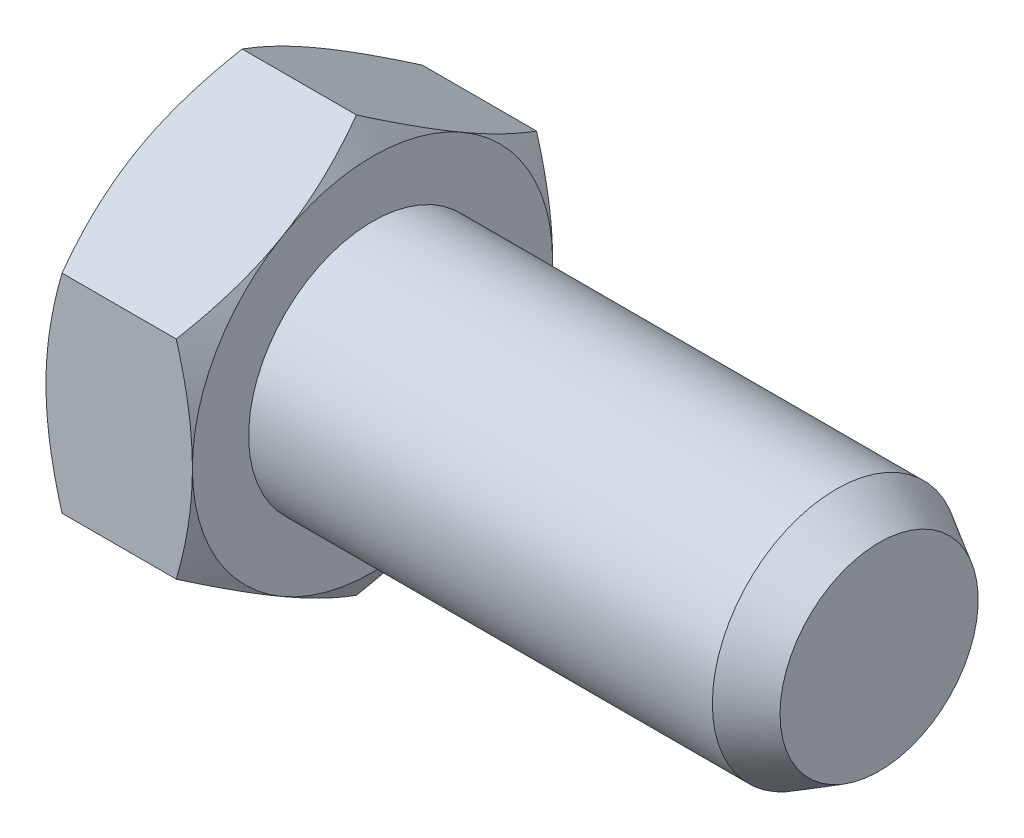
SolidWorks part; units mm, degrees
ref_plane "Front" through (0, 0, 0) normal (0, 0, 1) x (1, 0, 0)
ref_plane "Top" through (0, 0, 0) normal (0, 1, 0) x (1, 0, 0)
ref_plane "Right" through (0, 0, 0) normal (1, 0, 0) x (0, 0, -1)
sketch "Sketch1" plane through (0, 0, 0) normal (0, 0, 1) x (1, 0, 0)
  line L0 (0, 0) -> (0, 1.4)
  line L1 (0, 1.4) -> (1.3, 1.4)
  line L2 (1.3, 1.4) -> (1.3, 1.1)
  line L4 (1.3, 1.1) -> (5.8, 1.1)
  line L5 (5.8, 1.1) -> (5.8, 0)
  line L6 (5.8, 0) -> (0, 0)
  line L7 (13.1079, 0) -> (-2.2203, 0) construction
  dimension "da" = 2.8
  dimension "d" = 2.2
  dimension "k" = 1.3
  dimension "l" = 4.5
revolve "Revolve1" add sketch "Sketch1" angle 360 about L7
sketch "Sketch2" plane through (0, 0, 0) normal (-1, 0, 0) x (0, 0, 1)
  line L1 (1.6, -0.9238) -> (1.6, 0.9238)
  line L2 (1.6, 0.9238) -> (0, 1.8475)
  line L3 (0, 1.8475) -> (-1.6, 0.9238)
  line L4 (-1.6, 0.9238) -> (-1.6, -0.9238)
  line L5 (-1.6, -0.9238) -> (0, -1.8475)
  line L6 (0, -1.8475) -> (1.6, -0.9238)
  circle A0 centre (0, 0) radius 1.6 construction
  dimension "s" = 3.2
extrude "Extrude1" add sketch "Sketch2" against normal blind 1.3
sketch "Sketch3" plane through (0, 0, 0) normal (0, 1, 0) x (1, 0, 0)
  line L0 (-0.9238, 0) -> (0.65, 2.7258)
  line L1 (0.65, 2.7258) -> (1.3, 1.6)
  line L2 (0, 0) -> (-2.2444, 0) construction
  line L4 (1.3, 1.6) -> (1.3, 3.2258)
  line L5 (1.3, 3.2258) -> (-1.0238, 3.2258)
  line L6 (-0.9238, 0) -> (-1.0238, 0)
  line L7 (-1.0238, 0) -> (-1.0238, 3.2258)
  dimension "D1" = 60
  dimension "D2" = 0.5
  dimension "D3" = 0.1
  dimension "D4" = 60
revolve "Cut-Revolve2" cut sketch "Sketch3" angle 360 about L2
sketch "Sketch4" plane through (0, 0, 0) normal (0, 0, 1) x (1, 0, 0)
  line L0 (0, 0) -> (1.9538, 0) construction
  line L1 (-0.2, 0) -> (-0.2, 1.28)
  line L2 (-0.2, 1.28) -> (0.4, 1.28)
  line L3 (0.4, 1.28) -> (0.4, 0)
  line L4 (1.3, 1.4) -> (1.3, 1.1) construction
  line L5 (1.3, 1.4) -> (1.3, 1.8049) construction
  line L6 (0.4, 0) -> (-0.2, 0)
  dimension "D1" = 0.2
  dimension "D2" = 2.56
  dimension "k'" = 0.9
revolve "Cut-Revolve3" cut sketch "Sketch4" angle 360 about L0
chamfer "Chamfer1" distance 0.22 angle 60 1 edges at (5.8, 0, -1.1)
sketch "Sketch6" plane through (0, 0, 0) normal (0, 0, 1) x (1, 0, 0)
  line L0 (1.627, 0.75) -> (1.5502, 0.75)
  line L1 (1.5502, 0.75) -> (1.3481, 1.1)
  line L2 (1.627, 0.75) -> (1.829, 1.1)
  line L3 (1.3481, 1.1) -> (1.3481, 1.35)
  line L4 (1.829, 1.1) -> (1.829, 1.35)
  line L5 (1.3481, 1.35) -> (1.829, 1.35)
  line L6 (1.5886, 0.75) -> (1.5886, 0) construction
  line L7 (0, 0) -> (7.3035, 0) construction
  dimension "D1" = 2.2
  dimension "D2" = 60
  dimension "D3" = 0.25
  dimension "threadstart" = 1.5886
  dimension "minordia" = 1.5
  dimension "advance" = 0.4809
revolve "ThreadSchematic" [suppressed] cut sketch "Sketch6" angle 360 about L7
pattern_linear "ThdSchPat" [suppressed] count 10 spacing 0.4809 along (-1, 0, 0)
sketch "Sketch5" plane through (0, 0, 0) normal (0, 0, 1) x (1, 0, 0)
  line L0 (5.8, -0.88) -> (5.8, 0.88) construction
  line L2 (5.8, -1.1) -> (5.8, 0) construction
  line L3 (3.8, -1.1) -> (4.3, -1.1) construction
  line L4 (0, 0) -> (6.648, 0) construction
  line L5 (5.8, 0) -> (4.3, -1.1)
  line L6 (5.8, 0) -> (6, 0)
  line L7 (6, 0) -> (6, -1.3)
  line L8 (6, -1.3) -> (4.3, -1.3)
  line L9 (4.3, -1.3) -> (4.3, -1.1)
  line L10 (4.3, -1.1) -> (5.8, -1.1) construction
  dimension "D1" = 0.2
  dimension "y" = 2
  dimension "D2" = 0.5
  dimension "D3" = 0.2
  dimension "D4" = 2.2
revolve "EndCone" [suppressed] cut sketch "Sketch5" angle 360 about L4
equation "\"minordia@sketch6\" = \"D2@ThreadCosmetic\""
equation "\"D1@Extrude1\" = \"k@Sketch1\""
equation "\"D2@Sketch4\" = \"s@Sketch2\" * 4 / 5"
equation "\"D1@Chamfer1\" = \"d@Sketch1\" / 10"
equation "\"D2@Sketch5\" = \"y@Sketch5\" / 4"
equation "\"threadstart@Sketch6\" = \"D1@Extrude1\"+(\"advance@Sketch6\"*0.6)"
equation "\"D1@ThdSchPat\" = int((\"l@Sketch1\"/\"advance@Sketch6\") + 0.999)"
equation "\"D3@ThdSchPat\" = \"advance@Sketch6\""
equation "\"D1@Sketch6\" = \"d@Sketch1\""
equation "\"D4@Sketch5\" = \"d@Sketch1\""
